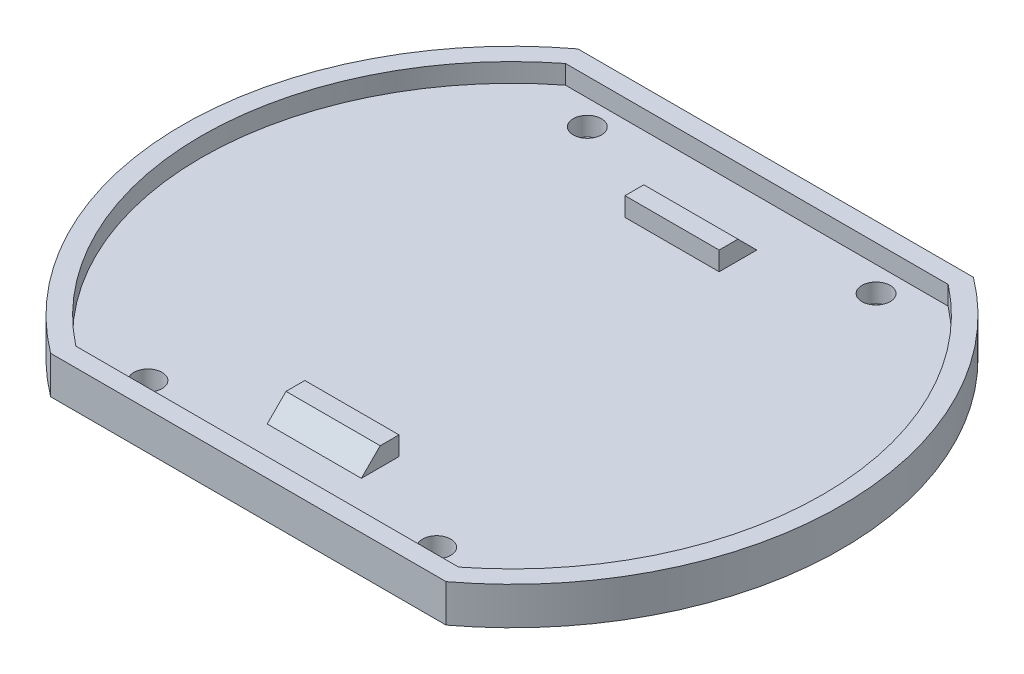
SolidWorks part; units mm, degrees
other "<a_base_t42>-<#8 Clearance Hole1>"
ref_plane "Front Plane" through (0, 0, 0) normal (0, 0, 1) x (1, 0, 0)
ref_plane "Top Plane" through (0, 0, 0) normal (0, 1, 0) x (1, 0, 0)
ref_plane "Right Plane" through (0, 0, 0) normal (1, 0, 0) x (0, 0, -1)
inserted part "a_base_t42"
sketch "Sketch1" plane through (0, 3, 0) normal (0, 1, 0) x (1, 0, 0)
  line L1 (30.4836, 39) -> (-30.4836, 39)
  line L2 (-30.4836, -39) -> (30.4836, -39)
  line L3 (-31.5, -42) -> (31.5, -42)
  line L4 (31.5, 42) -> (-31.5, 42)
  line L5 (-31.5, -42) -> (31.5, -42)
  line L6 (31.5, 42) -> (-31.5, 42)
  arc A0 (-30.4836, 39) -> (-30.4836, -39) centre (0, 0) ccw
  arc A1 (30.4836, -39) -> (30.4836, 39) centre (0, 0) ccw
  arc A2 (31.5, -42) -> (31.5, 42) centre (0, 0) ccw
  arc A3 (-31.5, 42) -> (-31.5, -42) centre (0, 0) ccw
  arc A4 (31.5, -42) -> (31.5, 42) centre (0, 0) ccw
  arc A5 (-31.5, 42) -> (-31.5, -42) centre (0, 0) ccw
  dimension "D1" = 0
  dimension "D2" = 3
extrude "Outer Brim" add sketch "Sketch1" along normal blind 3
sketch "Sketch5" plane through (0, 3, 0) normal (0, 1, 0) x (1, 0, 0)
  line L0 (0, 39) -> (0, 0) construction
  line L3 (30.4836, 39) -> (-30.4836, 39) construction
  line L4 (0, 0) -> (49.5, 0) construction
  line L5 (-7.5, -28.5) -> (-7.5, -25.5)
  line L6 (-7.5, 28.5) -> (7.5, 28.5)
  line L7 (-7.5, 28.5) -> (-7.5, 25.5)
  line L8 (-7.5, 25.5) -> (7.5, 25.5)
  line L9 (7.5, 28.5) -> (7.5, 25.5)
  line L10 (-7.5, -25.5) -> (7.5, -25.5)
  line L11 (7.5, -28.5) -> (7.5, -25.5)
  line L12 (-7.5, -28.5) -> (7.5, -28.5)
  arc A0 (30.4836, -39) -> (30.4836, 39) centre (0, 0) ccw construction
  dimension "D1" = 25.5
  dimension "D2" = 15
  dimension "D3" = 3
extrude "Base Supports" add sketch "Sketch5" along normal up to surface (3 mm away)
chamfer "Base Supports Chamfer" distance 3 angle 45 2 edges at (0, 3, 28.5) (0, 3, -28.5)
sketch "Sketch6" plane through (0, 3, 0) normal (0, 1, 0) x (1, 0, 0)
  circle A0 centre (-40.25, 0) radius 1 construction
  circle A1 centre (40.25, 0) radius 1 construction
  circle A2 centre (-40.25, 0) radius 1
  circle A3 centre (40.25, 0) radius 1
extrude "Cover" add sketch "Sketch6" against normal up to surface (3 mm away)
ref_point "Point1"
sketch "Sketch2" [suppressed] plane through (0, 3, 0) normal (0, 1, 0) x (1, 0, 0)
  line L0 (0, 39) -> (0, 0) construction
  line L1 (30.4836, 39) -> (-30.4836, 39) construction
  line L2 (0, 0) -> (-49.5, 0) construction
  line L3 (34, 22.5) -> (34, -22.5)
  line L4 (-34, 22.5) -> (-23.5, 22.5)
  line L5 (-34, 22.5) -> (-34, -22.5)
  line L6 (-34, -22.5) -> (-23.5, -22.5)
  line L7 (-23.5, 22.5) -> (-23.5, -22.5)
  line L8 (34, -22.5) -> (23.5, -22.5)
  line L9 (23.5, 22.5) -> (23.5, -22.5)
  line L10 (34, 22.5) -> (23.5, 22.5)
  arc A0 (-30.4836, 39) -> (-30.4836, -39) centre (0, 0) ccw construction
  dimension "D1" = 10.5
  dimension "D2" = 45
  dimension "D3" = 23.5
extrude "Dynamixel Offset" [suppressed] add sketch "Sketch2" along normal blind 1.25
sketch "Sketch3" [suppressed] plane through (0, 4.25, 0) normal (0, 1, 0) x (1, 0, 0)
  line L0 (-34, -22.5) -> (-23.5, -22.5) construction
  line L1 (-34, 22.5) -> (-31, 22.5)
  line L2 (-34, 22.5) -> (-34, -22.5)
  line L3 (-34, -22.5) -> (-31, -22.5)
  line L4 (-31, 22.5) -> (-31, -22.5)
  line L5 (-23.5, -22.5) -> (-23.5, 22.5) construction
  line L6 (-23.5, 0) -> (-26.5, 0)
  line L7 (-23.5, 0) -> (-23.5, -22.5)
  line L8 (-23.5, -22.5) -> (-26.5, -22.5)
  line L9 (-26.5, 0) -> (-26.5, -22.5)
  line L10 (23.5, 22.5) -> (23.5, -22.5) construction
  line L11 (23.5, 0) -> (26.5, 0)
  line L12 (23.5, 0) -> (23.5, 22.5)
  line L13 (23.5, 22.5) -> (26.5, 22.5)
  line L14 (26.5, 0) -> (26.5, 22.5)
  line L15 (34, 22.5) -> (23.5, 22.5) construction
  line L16 (23.5, -22.5) -> (34, -22.5) construction
  line L17 (34, 22.5) -> (31, 22.5)
  line L18 (34, 22.5) -> (34, -22.5)
  line L19 (34, -22.5) -> (31, -22.5)
  line L20 (31, 22.5) -> (31, -22.5)
  dimension "D1" = 3
extrude "Dynamixel Side Support Walls" [suppressed] add sketch "Sketch3" along normal blind 5.6
fillet "Dynamixel Support Contouring" [suppressed] radius 1
sketch "Sketch7" [suppressed] plane through (0, 3, 0) normal (0, 1, 0) x (1, 0, 0)
  line L0 (0, 39) -> (0, 0) construction
  line L1 (30.4836, 39) -> (-30.4836, 39) construction
  line L2 (0, 0) -> (-49.5, 0) construction
  line L3 (33.75, 27.82) -> (33.75, -27.82)
  line L4 (-33.75, 27.82) -> (-28.75, 27.82)
  line L5 (-33.75, 27.82) -> (-33.75, -27.82)
  line L6 (-33.75, -27.82) -> (-28.75, -27.82)
  line L7 (-28.75, 27.82) -> (-28.75, -27.82)
  line L8 (33.75, -27.82) -> (28.75, -27.82)
  line L9 (28.75, 27.82) -> (28.75, -27.82)
  line L10 (33.75, 27.82) -> (28.75, 27.82)
  arc A0 (-30.4836, 39) -> (-30.4836, -39) centre (0, 0) ccw construction
  dimension "D1" = 5
  dimension "D2" = 57.5
  dimension "D3" = 55.64
extrude "Servo Side Supports" [suppressed] add sketch "Sketch7" along normal blind 8.5
sketch "Sketch8" [suppressed] plane through (0, 11.5, 0) normal (0, 1, 0) x (1, 0, 0)
  line L0 (-28.75, -27.82) -> (-28.75, 27.82) construction
  line L1 (-33.75, 27.82) -> (-28.75, 27.82)
  line L2 (-33.75, 27.82) -> (-33.75, 20)
  line L3 (-33.75, 20) -> (-28.75, 20)
  line L4 (-28.75, 27.82) -> (-28.75, 20)
  line L5 (-71.1896, 0) -> (0, 0) construction
  line L6 (0, 0) -> (0, 70.1513) construction
  line L7 (28.75, 27.82) -> (28.75, 20)
  line L8 (33.75, 20) -> (28.75, 20)
  line L9 (33.75, 27.82) -> (33.75, 20)
  line L10 (33.75, 27.82) -> (28.75, 27.82)
  line L11 (33.75, -27.82) -> (28.75, -27.82)
  line L12 (33.75, -27.82) -> (33.75, -20)
  line L13 (33.75, -20) -> (28.75, -20)
  line L14 (28.75, -27.82) -> (28.75, -20)
  line L15 (-28.75, -27.82) -> (-28.75, -20)
  line L16 (-33.75, -20) -> (-28.75, -20)
  line L17 (-33.75, -27.82) -> (-33.75, -20)
  line L18 (-33.75, -27.82) -> (-28.75, -27.82)
  dimension "D1" = 40
extrude "Servo Side Extensions" [suppressed] add sketch "Sketch8" along normal blind 5
fillet "Servo Contouring" [suppressed] radius 1
equation "\"D2@Sketch1\"=\"width keep@values@params_print.SLDPRT\""
equation "\"D1@Outer Brim\"=\"width keep@values@params_print.SLDPRT\""
equation "\"D1@Sketch2\"=4.5+2*\"width keep@values@params_print.SLDPRT\""
equation "\"D3@Sketch2\"=26.5-\"width keep@values@params_print.SLDPRT\""
equation "\"D1@Sketch3\"=\"width keep@values@params_print.SLDPRT\""
equation "\"D3@Sketch5\"=\"width keep@values@params_print.SLDPRT\""
equation "\"D1@Base Supports Chamfer\"=\"width keep@values@params_print.SLDPRT\""
